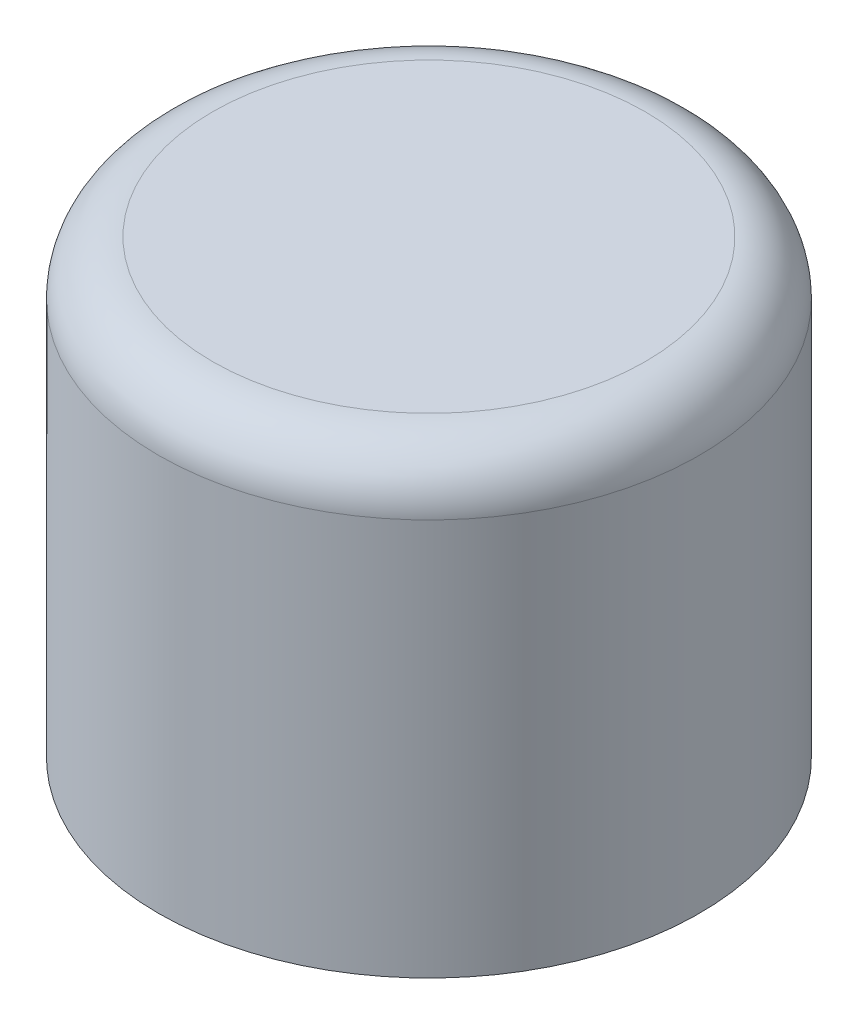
SolidWorks part; units mm, degrees
ref_plane "Front Plane" through (0, 0, 0) normal (0, 0, 1) x (1, 0, 0)
ref_plane "Top Plane" through (0, 0, 0) normal (0, 1, 0) x (1, 0, 0)
ref_plane "Right Plane" through (0, 0, 0) normal (1, 0, 0) x (0, 0, -1)
sketch "Sketch1" plane through (0, 0, 0) normal (0, 1, 0) x (1, 0, 0)
  circle A0 centre (0, 0) radius 3.81
extrude "Extrude1" add sketch "Sketch1" along normal blind 6.35
fillet "Fillet1" radius 0.762 1 edges at (0, 6.35, 3.81)
